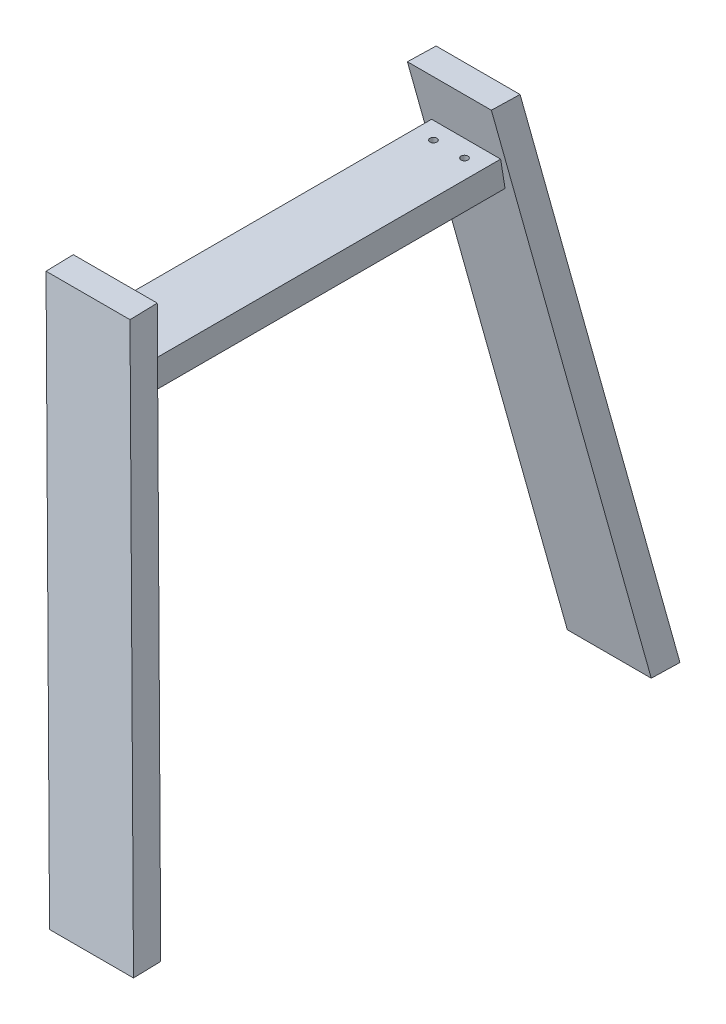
SolidWorks part; units mm, degrees
ref_plane "Piano frontale" through (0, 0, 0) normal (0, 0, 1) x (1, 0, 0)
ref_plane "Piano superiore" through (0, 0, 0) normal (0, 1, 0) x (1, 0, 0)
ref_plane "Piano destro" through (0, 0, 0) normal (1, 0, 0) x (0, 0, -1)
sketch "Schizzo1" plane through (0, 0, 0) normal (0, 0, 1) x (1, 0, 0)
  line L0 (0, -55) -> (0, 55) construction
  line L1 (-50, -40) -> (50, -40)
  line L2 (-50, -40) -> (-50, 0)
  line L3 (-50, 0) -> (50, 0)
  line L4 (50, -40) -> (50, 0)
  line L5 (-50, -40) -> (50, 0) construction
  line L6 (-50, 0) -> (50, -40) construction
  line L7 (55, 0) -> (-55, 0) construction
  point P0 (0, -20)
  dimension "D1" = 40
  dimension "D2" = 100
extrude "Estrusione-Sottile1" add sketch "Schizzo1" along normal blind 300 thin
sketch "Schizzo11" plane through (0, 0, 0) normal (0, 0, 1) x (1, 0, 0)
  line L1 (-50, -40) -> (50, -40)
  line L2 (-50, -40) -> (-50, 0)
  line L3 (-50, 0) -> (50, 0)
  line L4 (50, -40) -> (50, 0)
extrude "Estrusione-Estrusione4" add sketch "Schizzo11" along normal up to surface (300 mm away)
sketch "Schizzo2" plane through (0, 0, 0) normal (1, 0, 0) x (0, 0, -1)
  line L0 (-281.9371, 0) -> (-309, -645)
  line L1 (49.5, 0) -> (-49.5, 0) construction
  line L2 (-281.9371, 0) -> (-279, 70)
  dimension "D1" = 70
  dimension "D2" = 715
  dimension "D3" = 279
  dimension "D4" = 30
extrude "Taglio-Estrusione1" cut sketch "Schizzo2" against normal through all and the other way through all
ref_plane "Piano2" through (0, -645, 0) normal (0, 1, 0) x (1, 0, 0)
ref_plane "Piano4" through (0, -15, 0) normal (0, 1, 0) x (1, 0, 0)
sketch "Schizzo4" plane through (0, -645, 0) normal (0, 1, 0) x (1, 0, 0)
  line L0 (105, 0) -> (105, -375.5) construction
  line L1 (-22, 0) -> (22, 0) construction
  line L2 (0, -22) -> (0, 22) construction
  dimension "D1" = 375.5
  dimension "D2" = 105
sketch3d "Schizzo3D1"
  line L0 (0, -15, 275) -> (105, -645, 375.5)
  line L1 (0, -15, 275) -> (-11.3681, 53.2083, 264.1191)
  line L2 (-11.3681, 53.2083, 264.1191) -> (-32.2419, 178.4514, 244.1399)
  line L3 (105, -645, 375.5) -> (114.565, -702.39, 384.6551)
  dimension "D1" = 275
  dimension "D2" = 70
sketch "Schizzo12" plane through (0, 0, 0) normal (1, 0, 0) x (0, 0, -1)
  line L0 (-375.5, -645) -> (-384.6551, -702.39) construction
  line L1 (-275, -15) -> (-375.5, -645) construction
  line L2 (-275, -15) -> (-264.1191, 53.2083) construction
  line L3 (-264.1191, 53.2083) -> (-244.1399, 178.4514) construction
  line L4 (-375.5, -645) -> (-384.6551, -702.39)
  line L5 (-275, -15) -> (-375.5, -645)
  line L6 (-275, -15) -> (-264.1191, 53.2083)
  line L7 (-264.1191, 53.2083) -> (-244.1399, 178.4514)
extrude "Taglio-Estrusione6" cut sketch "Schizzo12" against normal through all both and the other way through all
ref_plane "Piano3" through (-32.2419, 178.4514, 244.1399) normal (-0.1624, 0.9744, -0.1554) x (0.9865, 0.1634, -0.0065)
sketch "Schizzo5" plane through (-32.2419, 178.4514, 244.1399) normal (-0.1624, 0.9744, -0.1554) x (0.9865, 0.1634, -0.0065)
  line L0 (51.7934, 1.0027) -> (-46.8607, -0.9072) construction
  line L1 (-60.3759, 18.8349) -> (59.6016, 21.1576)
  line L2 (-60.3759, 18.8349) -> (-59.6016, -21.1576)
  line L3 (-59.6016, -21.1576) -> (60.3759, -18.8349)
  line L4 (59.6016, 21.1576) -> (60.3759, -18.8349)
  line L5 (-60.3759, 18.8349) -> (60.3759, -18.8349) construction
  line L6 (-59.6016, -21.1576) -> (59.6016, 21.1576) construction
  point P0 (0, 0)
  dimension "D1" = 120
  dimension "D2" = 40
extrude "Estrusione-Estrusione2" add sketch "Schizzo5" against normal up to vertex (903.9792 mm away)
sketch "Schizzo10" [suppressed] plane through (-22.8242, 184.0204, 268.5879) normal (-0.1229, 0.9905, -0.0614) x (0.9924, 0.1229, -0.0028)
  line L0 (-44.414, 27.4298) -> (254.925, 27.4298) construction
  line L1 (-44.414, 27.4298) -> (52.1786, 1.5479)
  line L2 (-44.414, 27.4298) -> (-52.1786, -1.5479)
  line L3 (-52.1786, -1.5479) -> (44.414, -27.4298)
  line L4 (52.1786, 1.5479) -> (44.414, -27.4298)
  line L5 (-44.414, 27.4298) -> (44.414, -27.4298) construction
  line L6 (-52.1786, -1.5479) -> (52.1786, 1.5479) construction
  point P0 (0, 0)
  dimension "D1" = 15
  dimension "D2" = 100
  dimension "D3" = 30
extrude "Estrusione-Estrusione3" [suppressed] add sketch "Schizzo10" against normal up to vertex
sketch "Schizzo6" plane through (0, 0, 0) normal (0, 0, 1) x (1, 0, 0)
  line L0 (-112.8044, 65) -> (91.6074, 65)
  line L1 (130.7046, 0) -> (-130.7046, 0) construction
  dimension "D1" = 65
extrude "Taglio-Estrusione2" cut sketch "Schizzo6" against normal through all and the other way through all
sketch "Schizzo7" plane through (0, 0, 0) normal (0, 0, 1) x (1, 0, 0)
  line L0 (-408.7763, -645) -> (263.2439, -645)
  line L1 (132.2364, -645) -> (-132.2364, -645) construction
extrude "Taglio-Estrusione3" cut sketch "Schizzo7" against normal through all and the other way through all flip side to cut
sketch "Schizzo8" plane through (0, 0, 0) normal (0, 1, 0) x (1, 0, 0)
  line L0 (-22.5, -227.5) -> (22.5, -227.5) construction
  line L1 (0, 0) -> (0, -227.5) construction
  line L2 (0, -369.0215) -> (0, 369.0215) construction
  circle A0 centre (-22.5, -227.5) radius 5
  circle A1 centre (22.5, -227.5) radius 5
  dimension "D2" = 10
  dimension "D1" = 45
  dimension "D3" = 227.5
extrude "Taglio-Estrusione4" cut sketch "Schizzo8" against normal blind 70
sketch "Schizzo9" plane through (0, -40, 0) normal (0, -1, 0) x (1, 0, 0)
  circle A0 centre (22.5, 227.5) radius 9
  circle A1 centre (-22.5, 227.5) radius 9
  dimension "D1" = 18
extrude "Taglio-Estrusione5" cut sketch "Schizzo9" against normal blind 10
mirror "Specchia1" about plane through (0, 0, 0) normal (0, 0, 1)
